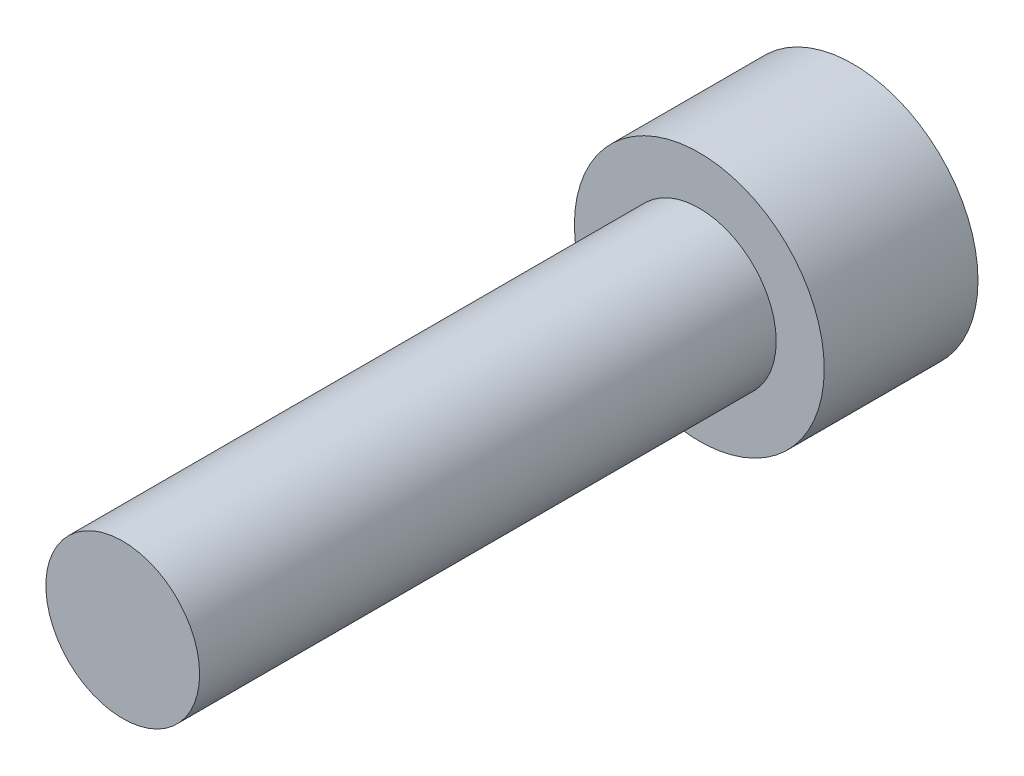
SolidWorks part; units mm, degrees
ref_plane "Front Plane" through (0, 0, 0) normal (0, 0, 1) x (1, 0, 0)
ref_plane "Top Plane" through (0, 0, 0) normal (0, 1, 0) x (1, 0, 0)
ref_plane "Right Plane" through (0, 0, 0) normal (1, 0, 0) x (0, 0, -1)
sketch "Sketch6" plane through (0, 0, 0) normal (1, 0, 0) x (0, 0, -1)
  line L0 (-30, 0) -> (22.525, 0) construction
  line L1 (7.15, 0) -> (-7.15, 0) construction
  line L2 (-30, 0) -> (-30, -4)
  line L3 (-30, -4) -> (0, -4)
  line L4 (0, 7.15) -> (0, -7.15) construction
  line L5 (0, -4) -> (0, -6.5)
  line L6 (0, -6.5) -> (8, -6.5)
  line L7 (8, -6.5) -> (8, 0)
  line L8 (8, 0) -> (-30, 0)
  dimension "L" = 30
  dimension "H" = 8
  dimension "A" = 13
  dimension "D" = 8
revolve "Revolve1" add sketch "Sketch6" angle 360 about L0
sketch "Sketch7" plane through (0, 0, -8) normal (0, 0, -1) x (-1, 0, 0)
  line L2 (-3, 1.7321) -> (-3, -1.7321)
  line L4 (-3, -1.7321) -> (0, -3.4641)
  line L5 (0, -3.4641) -> (3, -1.7321)
  line L6 (3, -1.7321) -> (3, 1.7321)
  line L7 (3, 1.7321) -> (0, 3.4641)
  line L8 (0, 3.4641) -> (-3, 1.7321)
  circle A0 centre (0, 0) radius 3 construction
  dimension "J" = 6
extrude "HEX" cut sketch "Sketch7" against normal blind 6
